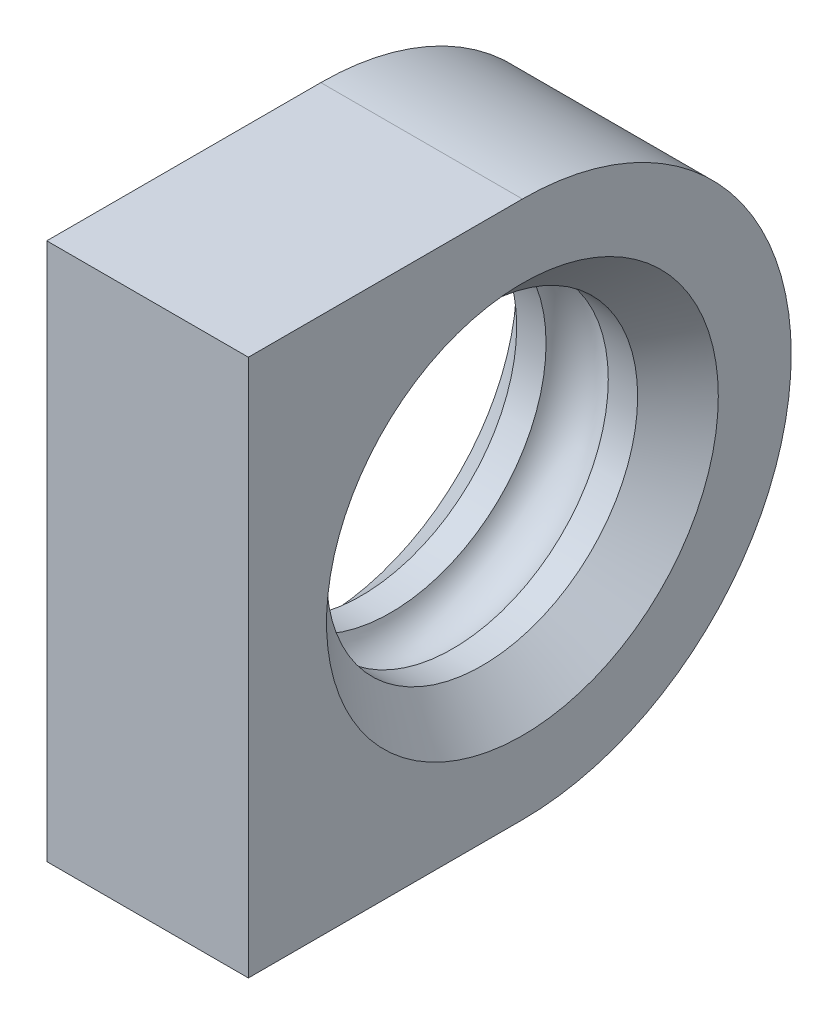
SolidWorks part; units mm, degrees
ref_plane "Front Plane" through (0, 0, 0) normal (0, 0, 1) x (1, 0, 0)
ref_plane "Top Plane" through (0, 0, 0) normal (0, 1, 0) x (1, 0, 0)
ref_plane "Right Plane" through (0, 0, 0) normal (1, 0, 0) x (0, 0, -1)
sketch "Sketch1" plane through (0, 0, 0) normal (1, 0, 0) x (0, 0, -1)
  line L0 (0, 0) -> (50, 0) construction
  line L1 (0, 6.35) -> (50, 6.35)
  line L2 (0, -6.35) -> (50, -6.35)
  arc A0 (0, 6.35) -> (0, -6.35) centre (0, 0) ccw
  arc A1 (50, -6.35) -> (50, 6.35) centre (50, 0) ccw
  circle A2 centre (0, 0) radius 3.175
  circle A3 centre (50, 0) radius 3.175
  circle A8 centre (0, 0) radius 3.675
  circle A9 centre (50, 0) radius 3.675
  point P3 (25, 0)
  dimension "D2" = 6.35
  dimension "D3" = 6.35
  dimension "D4" = 6.35
  dimension "D1" = 50
  dimension "D9" = 0.5
  dimension "D10" = 0.5
extrude "Boss-Extrude1" add sketch "Sketch1" along normal blind 4.7625
chamfer "Chamfer1" distance 0.9525 angle 45 4 edges at (4.7625, 0, -3.675) (0, 0, -3.675) (4.7625, 0, -53.675) (0, 0, -53.675)
sketch "Sketch2" plane through (0, 0, 0) normal (0, 1, 0) x (1, 0, 0)
  line L0 (3.81, 3.675) -> (3.81, -3.675) construction
  line L1 (0.4525, -3.675) -> (5.2078, -3.675) construction
  line L2 (0.4525, 3.675) -> (0.4525, -3.675)
  line L3 (0.4525, 3.675) -> (0.4525, -3.675) construction
  line L4 (3.81, 3.675) -> (3.81, -3.675) construction
  line L5 (4.7625, -6.35) -> (4.7625, 0) construction
  line L6 (0.4525, 0) -> (3.81, 0)
  circle A0 centre (2.3813, -3.375) radius 0.7938
  dimension "D2" = 1.5875
  dimension "D4" = 2.3813
  dimension "D3" = 0.3
  dimension "D1" = 0.5
revolve "Cut-Revolve1" cut sketch "Sketch2" angle 360 about L6
sketch "Sketch3" plane through (0, 0, 0) normal (-1, 0, 0) x (0, 0, 1)
  circle A0 centre (-50, 0) radius 3.675 construction
  circle A5 centre (-50, 0) radius 3.675 construction
  point P16 (-50, 0)
pattern_sketch "Sketch-Pattern2" of "Cut-Revolve1"
sketch "Sketch4" plane through (0, 0, 0) normal (-1, 0, 0) x (0, 0, 1)
  text T1 "<---50mm--->" font "Century Gothic" height 2.3813
extrude "Boss-Extrude2" add sketch "Sketch4" along normal blind 0.2
sketch "Sketch5" plane through (0, 0, 0) normal (-1, 0, 0) x (0, 0, 1)
  line L1 (26.0416, -24.168) -> (-43.5268, -24.168)
  line L2 (26.0416, -24.168) -> (26.0416, 26.7695)
  line L3 (26.0416, 26.7695) -> (-43.5268, 26.7695)
  line L4 (-43.5268, -24.168) -> (-43.5268, 26.7695)
  line L5 (26.0416, -24.168) -> (-43.5268, 26.7695) construction
  line L6 (26.0416, 26.7695) -> (-43.5268, -24.168) construction
  point P4 (-8.7426, 1.3008)
  point P5 (-43.5268, -24.168)
extrude "Cut-Extrude3" cut sketch "Sketch5" against normal through all both and the other way through all
